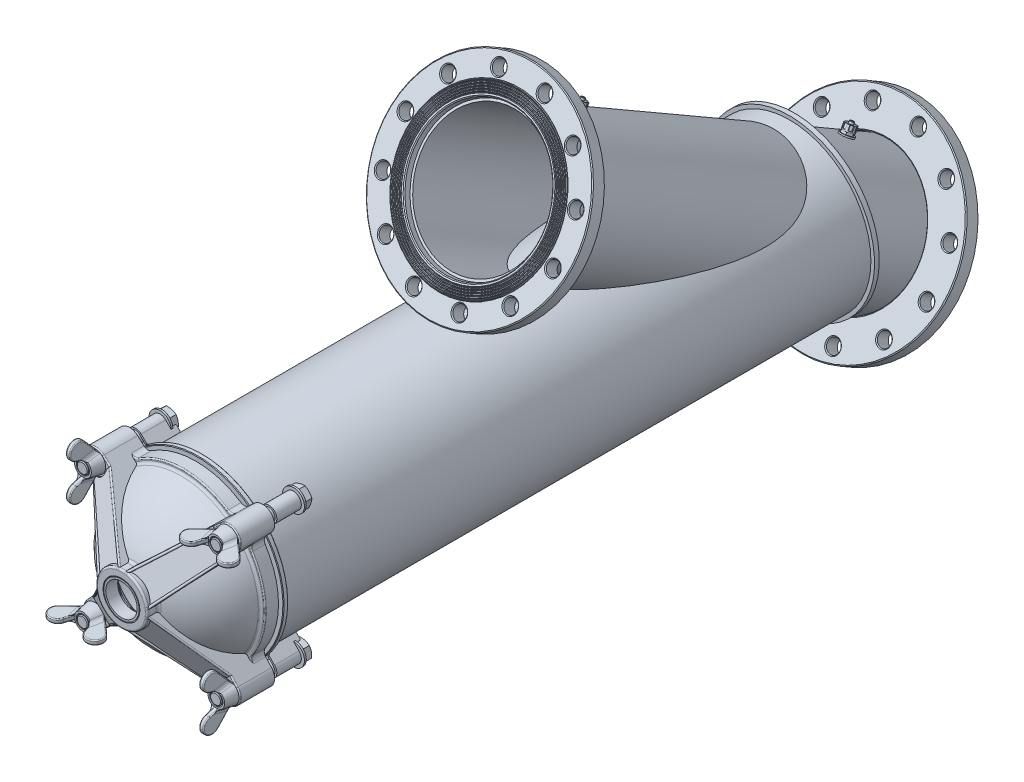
SolidWorks part; units mm, degrees
ref_plane "Front Plane" through (0, 0, 0) normal (0, 0, 1) x (1, 0, 0)
ref_plane "Top Plane" through (0, 0, 0) normal (0, 1, 0) x (1, 0, 0)
ref_plane "Right Plane" through (0, 0, 0) normal (1, 0, 0) x (0, 0, -1)
imported_body "DRB6-000248-1/DLB6-000185-1/DLB5-000124-1-1-solid1"
imported_body "DRB6-000248-1/DLB6-000185-1/DAB6-000662-1-solid1"
imported_body "DRB6-000248-1/DLB6-000185-1/DLB5-000119-2-1-solid1"
imported_body "DRB6-000248-1/DLB6-000185-1/DLB5-000185-1-1-solid1"
imported_body "DRB6-000248-1/DLB6-000185-1/DLB6-000185-3-1-solid1"
imported_body "DRB6-000248-1/DLB6-000185-1/DAB6-000663-1-solid1"
imported_body "DRB6-000248-1/DLB6-000185-1/DAB6-000662-2-solid1"
imported_body "DRB6-000248-1/DLB6-000185-1/DAB6-000662-3-solid1"
imported_body "DRB6-000248-1/DLB6-000185-1/DAB6-000662-4-solid1"
imported_body "DRB6-000248-1/DLB6-000185-1/740102-000124-1-solid1"
imported_body "DRB6-000248-1/DLB6-000185-1/740102-000124-2-solid1"
imported_body "DAB6-000679-1-solid1"
imported_body "DAB2-000591-1-solid1"
imported_body "DAB2-000591-2-solid1"
imported_body "780101-000937-1-solid1"
imported_body "DKB2-001305-1/DMA5-000547-1-solid1"
imported_body "DKB2-001305-2/DMA5-000547-1-solid1"
imported_body "DKB2-001305-2/770104-000067-1-solid1"
imported_body "760101-000297-1-solid1"
imported_body "760103-000070-1-solid1"
imported_body "760102-000076-1-solid1"
imported_body "760102-000076-2-solid1"
imported_body "760102-000076-3-solid1"
imported_body "760102-000076-4-solid1"
imported_body "760103-000070-2-solid1"
imported_body "760103-000070-3-solid1"
imported_body "760103-000070-4-solid1"
imported_body "760101-000297-2-solid1"
imported_body "760101-000297-3-solid1"
imported_body "760101-000297-4-solid1"
sketch "Sketch1" plane through (0, 0, 0) normal (1, 0, 0) x (0, 0, -1)
  line L0 (-1117.7, 39.1398) -> (-1117.7, 8.2508) construction
  line L1 (-1117.7, 35.4062) -> (-1215.5466, 35.4062)
  line L2 (-1117.7, 35.4062) -> (-1117.7, -34.7032)
  line L3 (-1117.7, -34.7032) -> (-1215.5466, -34.7032)
  line L4 (-1215.5466, 35.4062) -> (-1215.5466, -34.7032)
extrude "Cut-Extrude1" cut sketch "Sketch1" against normal through all and the other way through all
